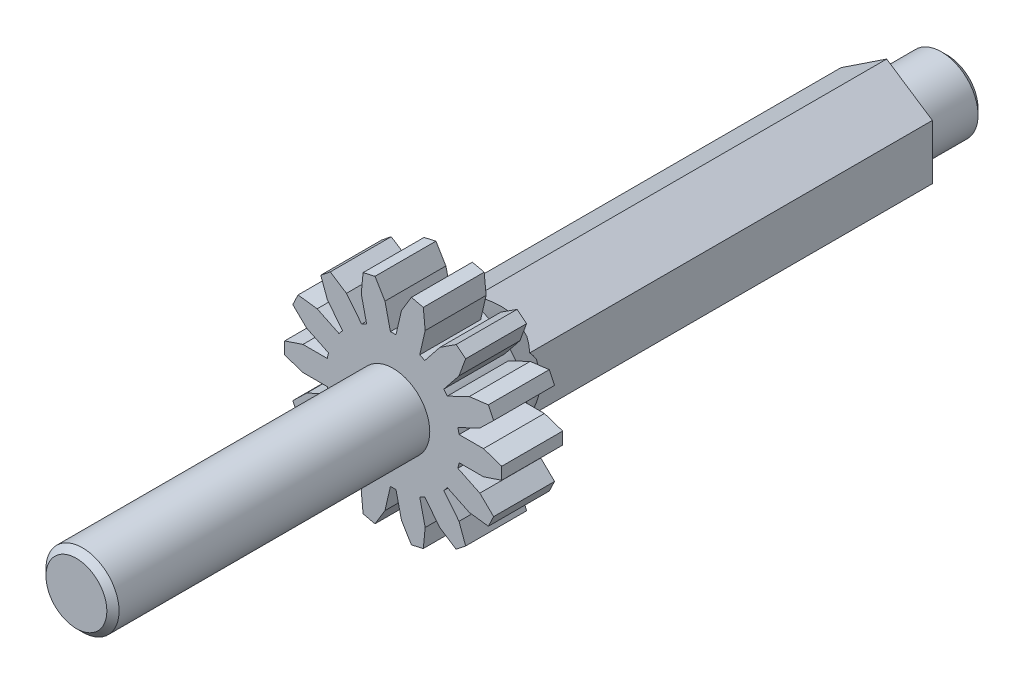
SolidWorks part; units mm, degrees
ref_plane "Plan de face" through (0, 0, 0) normal (0, 0, 1) x (1, 0, 0)
ref_plane "Plan de dessus" through (0, 0, 0) normal (0, 1, 0) x (1, 0, 0)
ref_plane "Plan de droite" through (0, 0, 0) normal (1, 0, 0) x (0, 0, -1)
imported_body "Importée3"
sketch "Esquisse1" plane through (0, 0, 70) normal (0, 0, 1) x (1, 0, 0)
  circle A0 centre (0, 0) radius 11
extrude "Boss.-Extru.1" add sketch "Esquisse1" along normal blind 11
sketch "Esquisse2" plane through (0, 0, 65) normal (0, 0, -1) x (-1, 0, 0)
  line L0 (-7.5, 4.5) -> (0, 9.4749)
  line L1 (0, 9.4749) -> (7.5, 4.5)
  line L2 (7.5, 4.5) -> (7.5, -4.5)
  line L3 (7.5, -4.5) -> (0, -9.4749)
  line L4 (0, -9.4749) -> (-7.5, -4.5)
  line L5 (-7.5, -4.5) -> (-7.5, 4.5)
extrude "Boss.-Extru.2" add sketch "Esquisse2" along normal blind 65
ref_plane "Plan1" through (0, 0, 81) normal (0, 0, 1) x (1, 0, 0)
sketch "Esquisse3" plane through (0, 0, 81) normal (0, 0, 1) x (1, 0, 0)
  line L0 (17.8167, 1) -> (14.8167, 2)
  line L1 (14.8167, 2) -> (10.8167, 2)
  line L2 (10.8167, -2) -> (14.8167, -2)
  line L3 (14.8167, -2) -> (17.8167, -1)
  line L4 (17.8167, -1) -> (17.8167, 1)
  arc A0 (10.8167, 2) -> (10.8167, -2) centre (0, 0) cw
extrude "Boss.-Extru.3" add sketch "Esquisse3" against normal blind 10
pattern_circular "Répétition circulaire1" count 14 over 360 about axis through (0, 0, 0) along (0, 0, 1) of "Boss.-Extru.3"
ref_plane "Plan2" through (0, 0, 0) normal (0, -1, 0) x (1, 0, 0)
sketch "Esquisse18" plane through (0, 0, 0) normal (0, -1, 0) x (1, 0, 0)
  line L0 (6, 133) -> (0, 133)
  line L1 (0, 133) -> (0, -10)
  line L2 (0, -10) -> (6, -10)
  line L3 (6, -10) -> (6, 133)
  line L4 (0, 0.0013) -> (0, -10) construction
  dimension "D1" = 6
  dimension "D2" = 143
  dimension "D3" = 10.0013
revolve "Révolution1" add sketch "Esquisse18" angle 360 about L4
chamfer "Chanfrein1" distance 1 angle 45 2 edges at (-6, 0, 133) (-6, 0, -10)
